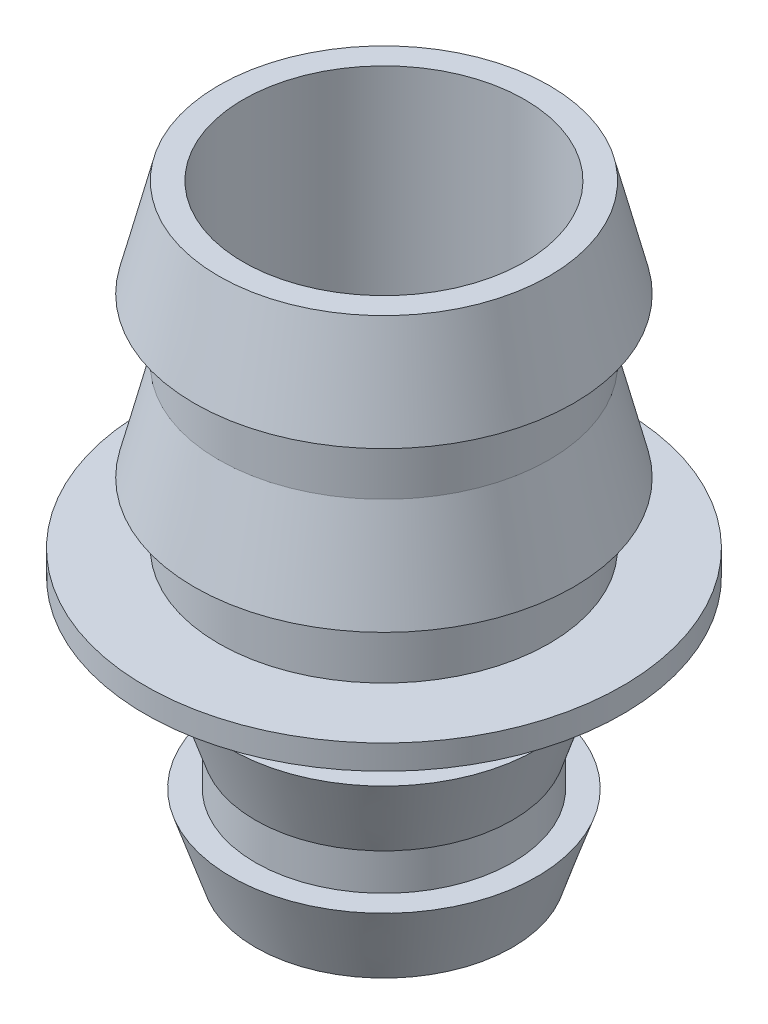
SolidWorks part; units mm, degrees
ref_plane "Front Plane" through (0, 0, 0) normal (0, 0, 1) x (1, 0, 0)
ref_plane "Top Plane" through (0, 0, 0) normal (0, 1, 0) x (1, 0, 0)
ref_plane "Right Plane" through (0, 0, 0) normal (1, 0, 0) x (0, 0, -1)
sketch "Sketch1" plane through (0, 0, 0) normal (0, 0, 1) x (1, 0, 0)
  line L0 (0, 0) -> (0, 10.5) construction
  line L1 (-6.75, 10.5) -> (-7.75, 6.5)
  line L2 (-7.75, 6.5) -> (-6.75, 6.5)
  line L3 (-6.75, 6.5) -> (-6.75, 4)
  line L4 (-6.75, 4) -> (-7.75, 0)
  line L5 (-7.75, 0) -> (-6.75, 0)
  line L6 (-6.75, 0) -> (-6.75, -2.5)
  line L7 (-6.75, 10.5) -> (-5.75, 10.5)
  line L8 (-5.75, 10.5) -> (-5.75, -2.5)
  line L9 (-6.75, -2.5) -> (-9.75, -2.5)
  line L10 (-9.75, -2.5) -> (-9.75, -3.5)
  line L11 (-9.75, -3.5) -> (-6.75, -3.5)
  line L12 (-5.25, 11) -> (-5.25, -6.5) construction
  line L13 (-4.25, -14) -> (-4.25, -3.5)
  line L14 (-5.75, -2.5) -> (-4.25, -3.5)
  line L15 (-6.75, -3.5) -> (-5.25, -4.5)
  line L16 (-5.25, -4.5) -> (-5.25, -6.5)
  line L17 (-5.25, -6.5) -> (-6.25, -6.5)
  line L18 (-6.25, -6.5) -> (-5.25, -9.5)
  line L19 (-5.25, -9.5) -> (-5.25, -11)
  line L20 (-5.25, -11) -> (-6.25, -11)
  line L21 (-6.25, -11) -> (-5.25, -14)
  line L22 (-5.25, -14) -> (-4.25, -14)
  point P16 (-5.3307, -9.5)
  point P26 (0, 0)
  dimension "D1" = 5.75
  dimension "D2" = 6.75
  dimension "D3" = 7.75
  dimension "D4" = 1
  dimension "D5" = 2.5
  dimension "D6" = 4
  dimension "D7" = 4
  dimension "D8" = 1
  dimension "D9" = 3
  dimension "D10" = 2.5
  dimension "D11" = 5.25
  dimension "D12" = 1
  dimension "D13" = 2
  dimension "D14" = 3
  dimension "D15" = 3
  dimension "D16" = 1.5
revolve "Revolve1" add sketch "Sketch1" angle 360 about L0
